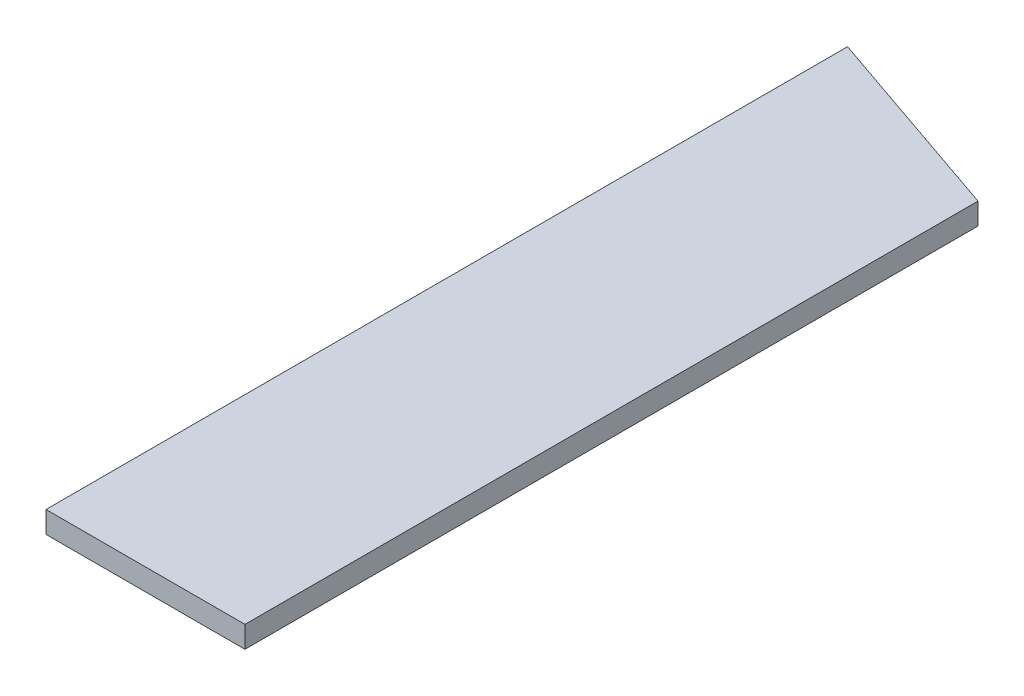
SolidWorks part; units mm, degrees
ref_plane "Front Plane" through (0, 0, 0) normal (0, 0, 1) x (1, 0, 0)
ref_plane "Top Plane" through (0, 0, 0) normal (0, 1, 0) x (1, 0, 0)
ref_plane "Right Plane" through (0, 0, 0) normal (1, 0, 0) x (0, 0, -1)
sketch "Sketch1" plane through (0, 0, 0) normal (0, 1, 0) x (1, 0, 0)
  line L1 (-584.2, 2361.3021) -> (584.2, 2361.3021)
  line L2 (-584.2, 2361.3021) -> (-584.2, -2361.3021)
  line L3 (-584.2, -2361.3021) -> (584.2, -2361.3021)
  line L4 (584.2, 2361.3021) -> (584.2, -2361.3021)
  line L5 (-584.2, 2361.3021) -> (584.2, -2361.3021) construction
  line L6 (-584.2, -2361.3021) -> (584.2, 2361.3021) construction
  point P0 (0, 0)
  dimension "D1" = 1168.4
  dimension "D2" = 4722.6042
extrude "Boss-Extrude1" add sketch "Sketch1" along normal blind 127
sketch "Sketch2" plane through (0, 0, 0) normal (0, -1, 0) x (1, 0, 0)
  line L0 (-584.2, -2346.2321) -> (-584.2, -2361.3021)
  line L1 (-584.2, -2361.3021) -> (-584.2, 2361.3021) construction
  line L2 (-627.9634, -2361.3011) -> (1137.2252, -1753.4979) construction
  line L3 (-584.2, -2361.3021) -> (584.2, -2361.3021)
  line L4 (584.2, -2361.3021) -> (584.2, -1943.9198)
  line L5 (584.2, 2361.3021) -> (584.2, -2361.3021) construction
  line L6 (584.2, -1943.9198) -> (-584.2, -2346.2321)
extrude "Cut-Extrude1" cut sketch "Sketch2" against normal through all
